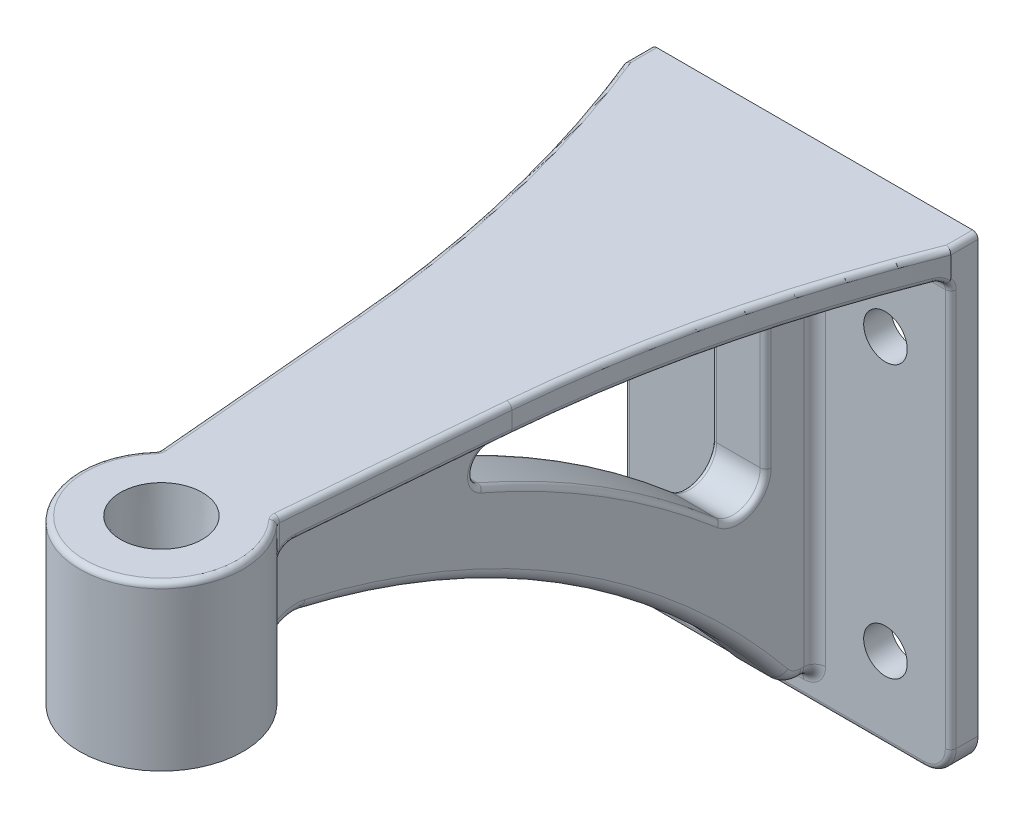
SolidWorks part; units mm, degrees
ref_plane "Front Plane" through (0, 0, 0) normal (0, 0, 1) x (1, 0, 0)
ref_plane "Top Plane" through (0, 0, 0) normal (0, 1, 0) x (1, 0, 0)
ref_plane "Right Plane" through (0, 0, 0) normal (1, 0, 0) x (0, 0, -1)
sketch "Sketch2" plane through (0, 0, 0) normal (0, 0, 1) x (1, 0, 0)
  line L1 (0, 0) -> (38.1, 0)
  line L2 (0, 0) -> (0, -107.95)
  line L3 (0, -107.95) -> (38.1, -107.95)
  line L4 (38.1, 0) -> (38.1, -107.95)
  dimension "D1" = 107.95
  dimension "D2" = 38.1
sketch "Sketch3" plane through (0, 0, 0) normal (1, 0, 0) x (0, 0, -1)
  line L0 (0, 0) -> (0, -101.6)
  line L1 (0, 0) -> (0, -107.95) construction
  line L2 (0, 0) -> (0, -107.95) construction
  line L3 (0, -101.6) -> (-12.7, -101.6)
  line L4 (0, 0) -> (-152.4, 0)
  line L5 (-152.4, 0) -> (-152.4, -25.4)
  arc A0 (-152.4, -25.4) -> (-12.7, -101.6) centre (-172.0833, -227.6444) cw
  dimension "D4" = 203.2
  dimension "D1" = 25.4
  dimension "D2" = 12.7
  dimension "D3" = 152.4
  dimension "D5" = 101.6
extrude "Boss-Extrude2" add sketch "Sketch3" along normal blind 6.35
extrude "Boss-Extrude3" add sketch "Sketch2" along normal blind 6.35
sketch "Sketch4" plane through (0, 0, 0) normal (0, 1, 0) x (1, 0, 0)
  line L0 (0, 0) -> (38.1, 0)
  line L1 (38.1, 0) -> (38.1, -6.35)
  line L2 (0, 0) -> (0, -152.4)
  line L3 (0, -152.4) -> (12.7, -152.4)
  line L4 (12.7, -152.4) -> (18.2555, -88.9)
  line L5 (18.2555, -88.9) -> (6.35, -88.9) construction
  line L6 (6.35, -6.35) -> (6.35, -152.4) construction
  arc A0 (18.2555, -88.9) -> (38.1, -6.35) centre (303.7945, -113.8814) cw
  dimension "D1" = 12.7
  dimension "D2" = 63.5
  dimension "D3" = 5
extrude "Boss-Extrude4" add sketch "Sketch4" against normal blind 6.35
sketch "Sketch5" plane through (0, 0, 6.35) normal (0, 0, 1) x (1, 0, 0)
  line L0 (22.86, -25.4) -> (22.86, -88.9) construction
  line L1 (0, -107.95) -> (38.1, -107.95) construction
  line L2 (6.35, -6.35) -> (38.1, -6.35) construction
  line L3 (38.1, -107.95) -> (38.1, -6.35) construction
  circle A0 centre (22.86, -25.4) radius 5.08
  circle A1 centre (22.86, -88.9) radius 5.08
  dimension "D4" = 10.16
  dimension "D1" = 19.05
  dimension "D2" = 19.05
  dimension "D3" = 15.24
extrude "Cut-Extrude1" cut sketch "Sketch5" against normal up to next
mirror "Mirror1" about plane through (0, -227.6444, 172.0833) normal (-1, 0, 0)
sketch "Sketch6" plane through (0, 0, 0) normal (0, 1, 0) x (1, 0, 0)
  line L0 (12.7, -152.4) -> (-12.7, -152.4) construction
  circle A0 centre (0, -152.4) radius 19.05
  dimension "D1" = 38.1
extrude "Boss-Extrude5" add sketch "Sketch6" against normal blind 38.1
sketch "Sketch7" plane through (0, 0, 0) normal (0, 1, 0) x (1, 0, 0)
  circle A0 centre (0, -152.4) radius 9.525
  dimension "D1" = 19.05
extrude "Cut-Extrude2" cut sketch "Sketch7" against normal up to next draft 3
fillet "Fillet1" radius 6.35 4 edges at (1.9825, -28.1501, 133.4534) (0, -101.6, 12.7) (38.1, -107.95, 3.175) (-38.1, -107.95, 3.175)
fillet "Fillet2" radius 2.54 19 edges at (6.35, -30.5702, 131.6146) (6.35, -101.6, 8.0026) (6.35, -100.9858, 12.3797) (22.225, -6.35, 6.35) (6.35, -6.35, 70.3947) (6.35, -21.0203, 134.4395) (6.35, -55.1477, 64.6817) (6.35, -53.975, 6.35) (-6.35, -53.975, 6.35) (-6.35, -101.6, 8.0026) (-6.35, -31.4852, 132.7233) (-6.35, -55.1477, 64.6817) (10.3875, -6.35, 136.4312) (-10.3875, -6.35, 136.4312) (-6.35, -21.0203, 134.4395) (-6.35, -6.35, 70.3947) (-22.225, -6.35, 6.35) (-6.35, -100.9858, 12.3797) (0, -101.6, 6.35)
fillet "Fillet3" radius 1.27 22 edges at (-25.1043, 0, 46.8862) (-16.0502, 0, 114.1074) (0, 0, 171.45) (16.0502, 0, 114.1074) (-38.1, 0, 3.175) (-13.8448, -4.445, 139.3148) (13.8448, -4.445, 139.3148) (38.1, 0, 3.175) (25.1043, 0, 46.8862) (13.8865, -7.5867, 138.8387) (16.1919, -6.35, 112.4873) (37.7541, -6.9862, 7.2086) (-13.9179, -7.2099, 138.479) (38.1, -55.245, 6.35) (36.2401, -106.0901, 6.35) (0, -107.95, 6.35) (-36.2401, -106.0901, 6.35) (-38.1, -55.245, 6.35) (-37.902, -7.3895, 6.8406) (-24.7879, -6.35, 48.2165) (24.7879, -6.35, 48.2165) (-16.1919, -6.35, 112.4873)
sketch "Sketch8" plane through (0, 0, 6.35) normal (0, 0, 1) x (1, 0, 0)
  circle A0 centre (22.86, -25.4) radius 12.7
  circle A1 centre (22.86, -25.4) radius 5.334
  circle A2 centre (22.86, -88.9) radius 12.7
  circle A3 centre (22.86, -88.9) radius 5.334
  circle A4 centre (-22.86, -88.9) radius 12.7
  circle A5 centre (-22.86, -88.9) radius 5.334
  circle A6 centre (-22.86, -25.4) radius 12.7
  circle A7 centre (-22.86, -25.4) radius 5.334
  dimension "D1" = 10.668
  dimension "D2" = 25.4
sketch "Sketch9" plane through (6.35, 0, 0) normal (1, 0, 0) x (0, 0, -1)
  line L8 (-17.78, -69.4589) -> (-17.78, -17.78)
  line L9 (-17.78, -17.78) -> (-102.8801, -17.78)
  line L10 (-17.78, -69.4589) -> (-17.78, -17.78)
  line L11 (-17.78, -17.78) -> (-102.8801, -17.78)
  arc A2 (-17.78, -69.4589) -> (-102.8801, -17.78) centre (-172.0833, -227.6444) ccw
  arc A3 (-17.78, -69.4589) -> (-102.8801, -17.78) centre (-172.0833, -227.6444) ccw
  dimension "D1" = 17.78
extrude "Cut-Extrude3" cut sketch "Sketch9" against normal through all
fillet "Fillet6" radius 6.35 1 edges at (0, -69.4589, 17.78)
fillet "Fillet4" radius 3.81 2 edges at (0, -17.78, 102.8801) (0, -17.78, 17.78)
fillet "Fillet5" radius 1.27 12 edges at (-6.35, -18.8959, 18.8959) (-6.35, -38.3201, 17.78) (-6.35, -40.4092, 54.7158) (-6.35, -20.8122, 85.9681) (6.35, -18.8959, 18.8959) (6.35, -38.3201, 17.78) (6.35, -40.4092, 54.7158) (6.35, -20.8122, 85.9681) (-6.35, -17.78, 51.9142) (6.35, -17.78, 51.9142) (-6.35, -60.8194, 21.4768) (6.35, -60.8194, 21.4768)
